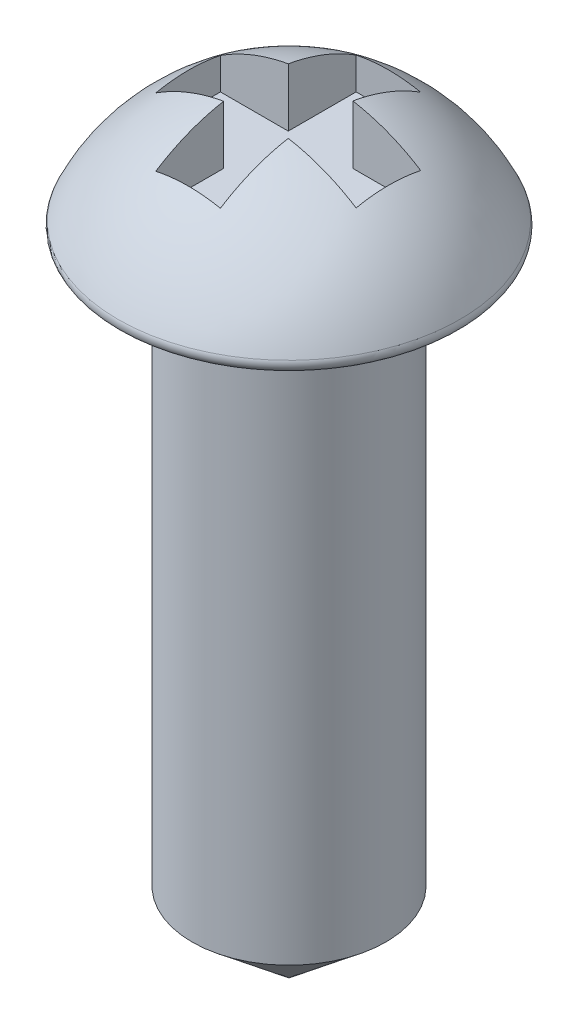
SolidWorks part; units mm, degrees
ref_plane "Plan de face" through (0, 0, 0) normal (0, 0, 1) x (1, 0, 0)
ref_plane "Plan de dessus" through (0, 0, 0) normal (0, 1, 0) x (1, 0, 0)
ref_plane "Plan de droite" through (0, 0, 0) normal (1, 0, 0) x (0, 0, -1)
sketch "Esquisse1" plane through (0, 0, 0) normal (0, 0, 1) x (1, 0, 0)
  line L0 (0, 3.8001) -> (0, -9.8448) construction
  line L1 (2, 0) -> (1.1, 0)
  line L2 (1.1, 0) -> (1.1, -6.4)
  line L3 (1.1, -6.4) -> (0, -7.3029)
  line L4 (0, -7.3029) -> (0, 1.3824)
  arc A0 (2, 0) -> (0, 1.3824) centre (0, -0.7556) ccw
  dimension "D1" = 1.1
  dimension "D2" = 6.4
  dimension "D3" = 2
revolve "Révolution1" add sketch "Esquisse1" angle 360 about L0
fillet "Congé1" radius 0.1 1 edges at (0, 0, 2)
ref_plane "Plan1" through (0, 1.1565, 0) normal (0, 1, 0) x (-1, 0, 0)
sketch "Esquisse2" plane through (0, 1.1565, 0) normal (0, 1, 0) x (-1, 0, 0)
  line L0 (0.0048, 1.1408) -> (0.0048, 0.0036) construction
  line L1 (-0.3619, 1.1408) -> (0.3716, 1.1408)
  line L2 (-0.3619, 1.1408) -> (-0.3619, 0.3704)
  line L3 (-0.3619, -1.1335) -> (0.3716, -1.1335)
  line L4 (0.3716, 1.1408) -> (0.3716, 0.3704)
  line L5 (-1.1323, 0.3704) -> (-0.3619, 0.3704)
  line L6 (-1.1323, 0.3704) -> (-1.1323, -0.3632)
  line L7 (-1.1323, -0.3632) -> (-0.3619, -0.3632)
  line L8 (1.142, 0.3704) -> (1.142, -0.3632)
  line L9 (0.0048, 0.0036) -> (0.0048, -1.1335) construction
  line L10 (1.142, 0.0036) -> (0.0048, 0.0036) construction
  line L11 (0.0048, 0.0036) -> (-1.1323, 0.0036) construction
  line L12 (0.3716, -0.3632) -> (1.142, -0.3632)
  line L13 (-0.3619, -0.3632) -> (-0.3619, -1.1335)
  line L14 (0.3716, 0.3704) -> (1.142, 0.3704)
  line L15 (0.3716, -0.3632) -> (0.3716, -1.1335)
extrude "Enlèv. mat.-Extru.1" cut sketch "Esquisse2" against normal mid plane 1
